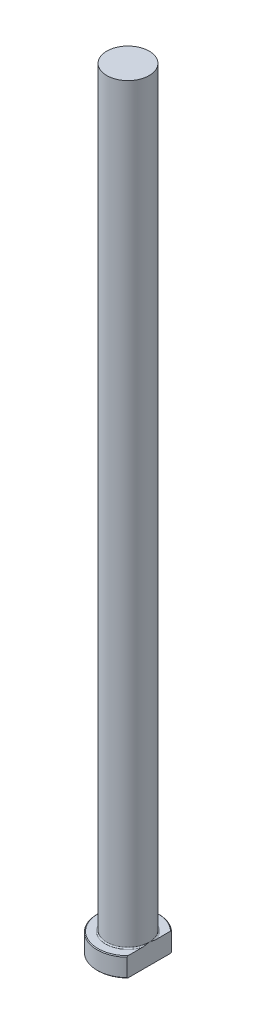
SolidWorks part; units mm, degrees
ref_plane "Front Plane" through (0, 0, 0) normal (0, 0, 1) x (1, 0, 0)
ref_plane "Top Plane" through (0, 0, 0) normal (0, 1, 0) x (1, 0, 0)
ref_plane "Right Plane" through (0, 0, 0) normal (1, 0, 0) x (0, 0, -1)
sketch "Sketch1" plane through (0, 0, 0) normal (0, 0, 1) x (1, 0, 0)
  line L0 (0, 259.9588) -> (0, -15.1925) construction
  line L1 (0, 0) -> (-8, 0)
  line L2 (-8, 0) -> (-8, 5)
  line L3 (-8, 5) -> (-5.5, 5)
  line L4 (-5.5, 5) -> (-5.5, 200)
  line L5 (-5.5, 200) -> (0, 200)
  line L6 (0, 200) -> (0, 0)
  dimension "L" = 200
  dimension "H" = 16
  dimension "T" = 5
  dimension "D" = 11
revolve "Revolve1" add sketch "Sketch1" angle 360 about L0
chamfer "Chamfer1" distance 0.2 angle 45 2 edges at (0, 5, 8) (0, 0, 8)
fillet "Fillet1" radius 0.3 1 edges at (0, 5, 5.5)
sketch "Sketch2" plane through (0, 0, 0) normal (0, 1, 0) x (1, 0, 0)
  line L0 (5.5, 5.8095) -> (5.5, -5.8095)
  circle A0 centre (0, 0) radius 8 construction
  arc A1 (5.5, -5.8095) -> (5.5, 5.8095) centre (0, 0) ccw
  circle A2 centre (0, 0) radius 5.5 construction
extrude "KEY" cut sketch "Sketch2" along normal through all
